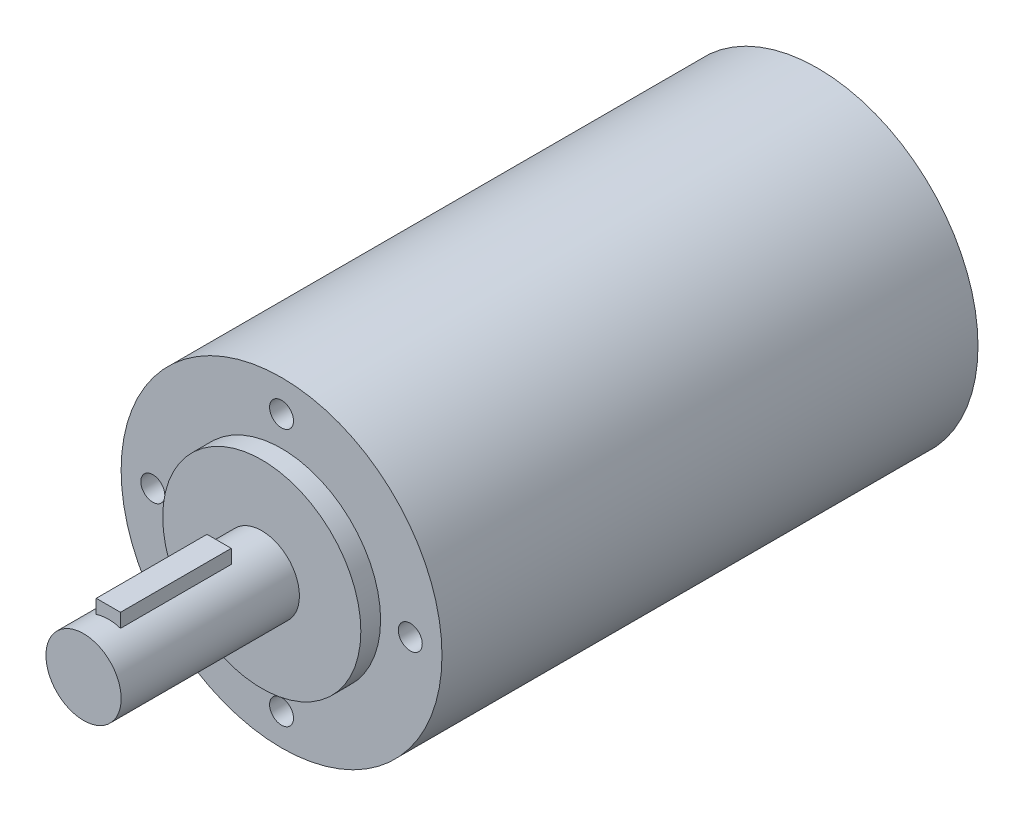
SolidWorks part; units mm, degrees
ref_plane "Front Plane" through (0, 0, 0) normal (0, 0, 1) x (1, 0, 0)
ref_plane "Top Plane" through (0, 0, 0) normal (0, 1, 0) x (1, 0, 0)
ref_plane "Right Plane" through (0, 0, 0) normal (1, 0, 0) x (0, 0, -1)
sketch "Sketch1" plane through (0, 0, 0) normal (0, 0, 1) x (1, 0, 0)
  circle A0 centre (0, 0) radius 40.8305
  dimension "D1" = 81.661
extrude "Extrude1" add sketch "Sketch1" along normal blind 136.4234
sketch "Sketch2" plane through (0, 0, 0) normal (0, 0, -1) x (-1, 0, 0)
  circle A0 centre (0, 0) radius 18.161
  dimension "D1" = 36.322
extrude "Cut-Extrude1" cut sketch "Sketch2" against normal blind 4.7498
sketch "Sketch3" plane through (0, 0, 136.4234) normal (0, 0, 1) x (1, 0, 0)
  circle A0 centre (0, 0) radius 25.2095
  dimension "D1" = 50.419
extrude "Extrude2" add sketch "Sketch3" along normal blind 5.0292
sketch "Sketch4" plane through (0, 0, 141.4526) normal (0, 0, 1) x (1, 0, 0)
  circle A0 centre (0, 0) radius 9.5758
  dimension "D1" = 19.1516
extrude "Extrude3" add sketch "Sketch4" along normal blind 45.3644
sketch "Sketch5" plane through (0, 0, 136.4234) normal (0, 0, 1) x (1, 0, 0)
  circle A0 centre (0, 32.766) radius 3.048
  dimension "D2" = 6.096
  dimension "D1" = 32.766
extrude "Cut-Extrude2" cut sketch "Sketch5" against normal blind 15.24
pattern_circular "CirPattern1" count 4 over 360 about axis through (0, 0, 0) along (0, 0, 1) of "Cut-Extrude2"
ref_plane "Plane1" through (0, 7.0358, 0) normal (0, 1, 0) x (-1, 0, 0)
sketch "Sketch6" plane through (0, 7.0358, 0) normal (0, 1, 0) x (-1, 0, 0)
  line L0 (9.5758, 186.817) -> (-9.5758, 186.817) construction
  line L1 (3.1242, 180.467) -> (-3.048, 180.467)
  line L2 (3.1242, 180.467) -> (3.1242, 152.273)
  line L3 (3.1242, 152.273) -> (-3.048, 152.273)
  line L4 (-3.048, 180.467) -> (-3.048, 152.273)
  dimension "D1" = 6.1722
  dimension "D2" = 3.048
  dimension "D3" = 6.35
  dimension "D4" = 28.194
extrude "Extrude4" add sketch "Sketch6" along normal blind 5.588
